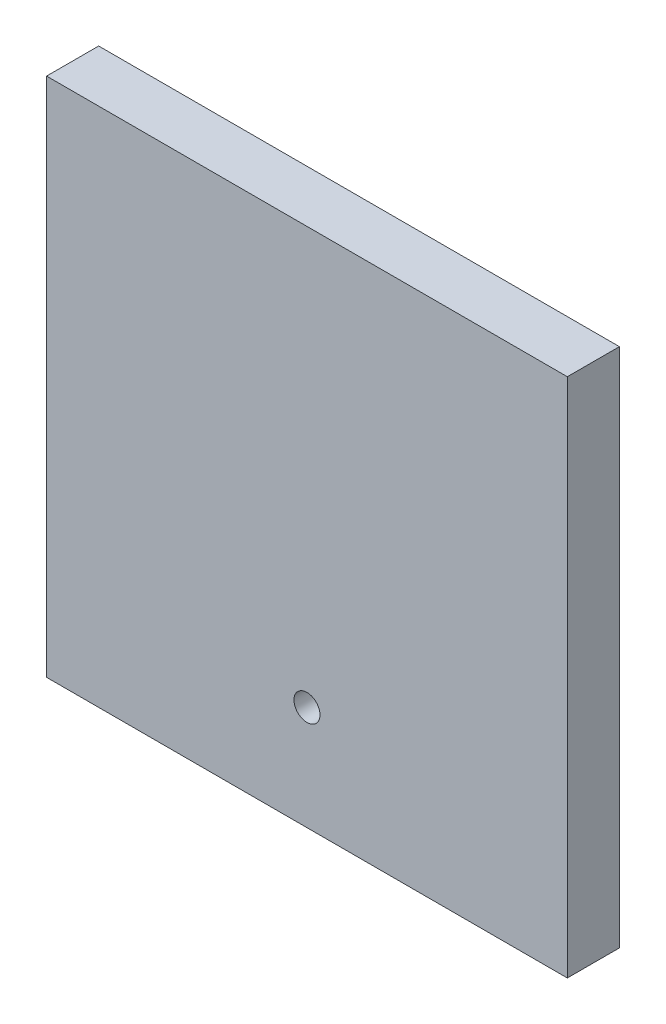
SolidWorks part; units mm, degrees
ref_plane "Спереди" through (0, 0, 0) normal (0, 0, 1) x (1, 0, 0)
ref_plane "Сверху" through (0, 0, 0) normal (0, 1, 0) x (1, 0, 0)
ref_plane "Справа" through (0, 0, 0) normal (1, 0, 0) x (0, 0, -1)
sketch "Эскиз1" plane through (0, 0, 0) normal (0, 0, 1) x (1, 0, 0)
  line L1 (0, 0) -> (100, 0)
  line L2 (0, 0) -> (0, 100)
  line L3 (0, 100) -> (100, 100)
  line L4 (100, 0) -> (100, 100)
extrude "Бобышка-Вытянуть1" add sketch "Эскиз1" along normal blind 10
sketch "Эскиз3" plane through (0, 0, 10) normal (0, 0, 1) x (1, 0, 0)
  line L0 (0, 10) -> (100, 10) construction
  line L1 (0, 100) -> (0, 0) construction
  line L2 (100, 0) -> (100, 100) construction
  line L3 (0, 0) -> (100, 0) construction
  line L4 (50, 100) -> (50, 0) construction
  line L5 (100, 100) -> (0, 100) construction
  line L6 (0, 20) -> (100, 20) construction
  circle A0 centre (50, 20) radius 2.5
  dimension "D1" = 10
  dimension "D2" = 20
extrude "Вырез-Вытянуть2" cut sketch "Эскиз3" against normal blind 10
